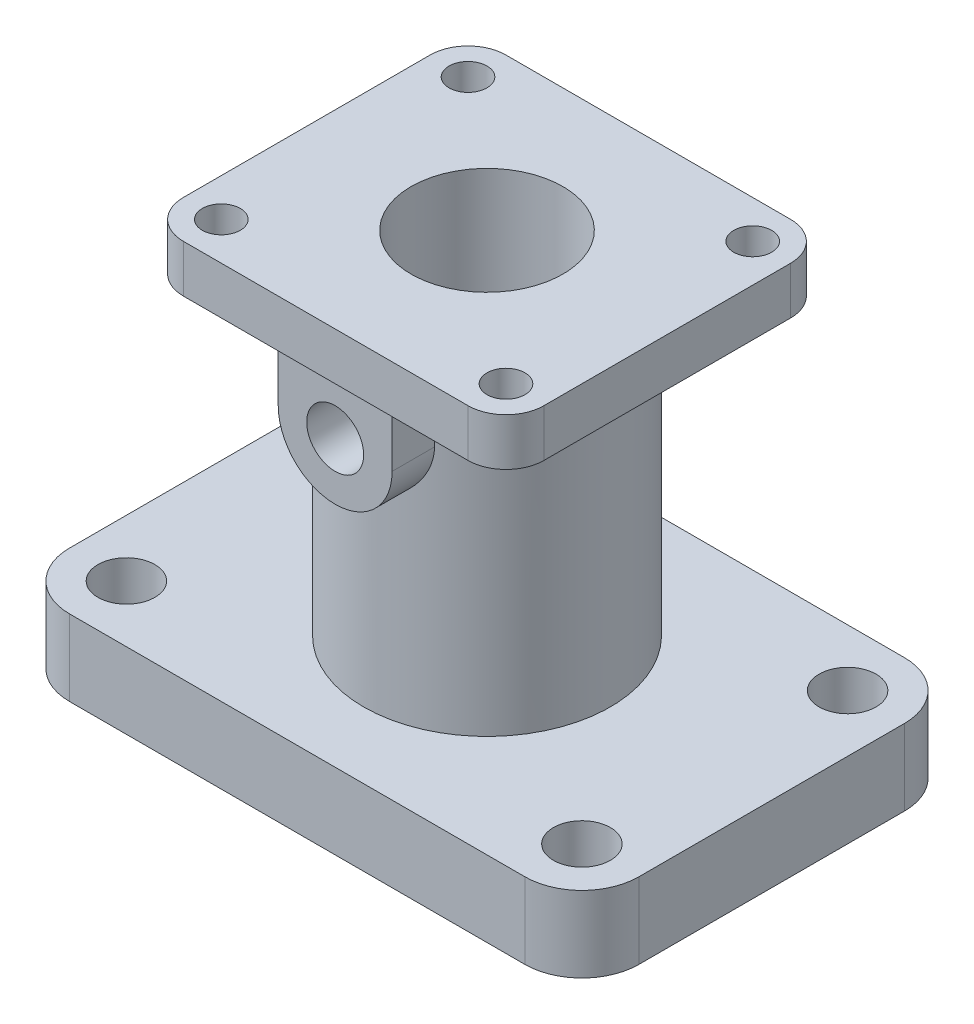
SolidWorks part; units mm, degrees
ref_plane "前视基准面" through (0, 0, 0) normal (0, 0, 1) x (1, 0, 0)
ref_plane "上视基准面" through (0, 0, 0) normal (0, 1, 0) x (1, 0, 0)
ref_plane "右视基准面" through (0, 0, 0) normal (1, 0, 0) x (0, 0, -1)
sketch "草图1" plane through (0, 0, 0) normal (0, 1, 0) x (1, 0, 0)
  line L0 (0, 0) -> (110.7966, 0) construction
  line L1 (110.7966, 0) -> (0, 0) construction
  line L2 (0, 0) -> (0, 81.8931) construction
  line L4 (-15, 10) -> (15, 10)
  line L5 (-15, 10) -> (-15, -10)
  line L6 (-15, -10) -> (15, -10)
  line L7 (15, 10) -> (15, -10)
extrude "拉伸1" add sketch "草图1" along normal blind 4
fillet "圆角1" radius 3 4 edges at (-15, 2, -10) (15, 2, -10) (-15, 2, 10) (15, 2, 10)
sketch "草图2" plane through (0, 4, 0) normal (0, 1, 0) x (1, 0, 0)
  circle A0 centre (0, 0) radius 6.5
extrude "拉伸2" add sketch "草图2" along normal blind 16
sketch "草图3" plane through (0, 20, 0) normal (0, 1, 0) x (1, 0, 0)
  line L0 (0, 0) -> (13.6973, 0) construction
  line L1 (13.6973, 0) -> (0, 0) construction
  line L2 (0, 0) -> (0, 11.9732) construction
  line L4 (-9.5, 8.5) -> (9.5, 8.5)
  line L5 (-9.5, 8.5) -> (-9.5, -8.5)
  line L6 (-9.5, -8.5) -> (9.5, -8.5)
  line L7 (9.5, 8.5) -> (9.5, -8.5)
extrude "拉伸3" add sketch "草图3" along normal blind 2.5
fillet "圆角2" radius 2 4 edges at (-9.5, 21.25, -8.5) (9.5, 21.25, -8.5) (-9.5, 21.25, 8.5) (9.5, 21.25, 8.5)
sketch "草图4" plane through (0, 0, 0) normal (0, -1, 0) x (1, 0, 0)
  line L0 (0, 0) -> (15.613, 0) construction
  line L1 (15.613, 0) -> (0, 0) construction
  line L2 (0, 0) -> (0, 11.6379) construction
  circle A0 centre (12, 7) radius 1.5
  circle A1 centre (12, -7) radius 1.5
  circle A2 centre (-12, -7) radius 1.5
  circle A3 centre (-12, 7) radius 1.5
extrude "切除-拉伸1" cut sketch "草图4" against normal up to next
sketch "草图5" plane through (0, 22.5, 0) normal (0, 1, 0) x (1, 0, 0)
  line L0 (0, 0) -> (15, 0) construction
  line L1 (15, -7) -> (15, 7) construction
  line L2 (15, 0) -> (0, 0) construction
  line L3 (0, 0) -> (0, 10) construction
  line L4 (12, 10) -> (-12, 10) construction
  circle A0 centre (7.5, 6.5) radius 1
  circle A1 centre (7.5, -6.5) radius 1
  circle A2 centre (-7.5, -6.5) radius 1
  circle A3 centre (-7.5, 6.5) radius 1
extrude "切除-拉伸2" cut sketch "草图5" against normal up to next
sketch "草图6" plane through (0, 0, 0) normal (0, 0, 1) x (1, 0, 0)
  line L0 (0, 0) -> (3, 0)
  line L1 (-12, 0) -> (12, 0) construction
  line L2 (3, 0) -> (3, 10)
  line L3 (3, 10) -> (4.648, 11.648) construction
  line L4 (4, 11) -> (4, 22.5)
  line L5 (-7.5, 22.5) -> (7.5, 22.5) construction
  line L6 (4, 22.5) -> (0, 22.5)
  line L7 (0, 22.5) -> (0, 0)
  line L8 (-12, 4) -> (12, 4) construction
  line L9 (4, 11) -> (3, 10)
  dimension "D1" = 4
  dimension "D2" = 45
revolve "切除-旋转1" cut sketch "草图6" angle 360 about L7
ref_plane "基准面1" through (0, 0, 8) normal (0, 0, 1) x (1, 0, 0)
sketch "草图7" plane through (0, 0, 8) normal (0, 0, 1) x (1, 0, 0)
  line L0 (3, 17) -> (3, 20)
  line L1 (-6.5, 20) -> (6.5, 20) construction
  line L2 (3, 20) -> (-3, 20)
  line L3 (-3, 20) -> (-3, 17)
  arc A0 (-3, 17) -> (3, 17) centre (0, 17) ccw
  circle A1 centre (0, 17) radius 1.5
extrude "拉伸4" add sketch "草图7" against normal up to next
sketch "草图8" plane through (0, 0, 8) normal (0, 0, 1) x (1, 0, 0)
  circle A0 centre (0, 17) radius 1.5
extrude "切除-拉伸3" cut sketch "草图8" against normal up to surface (4.2919 mm away)
